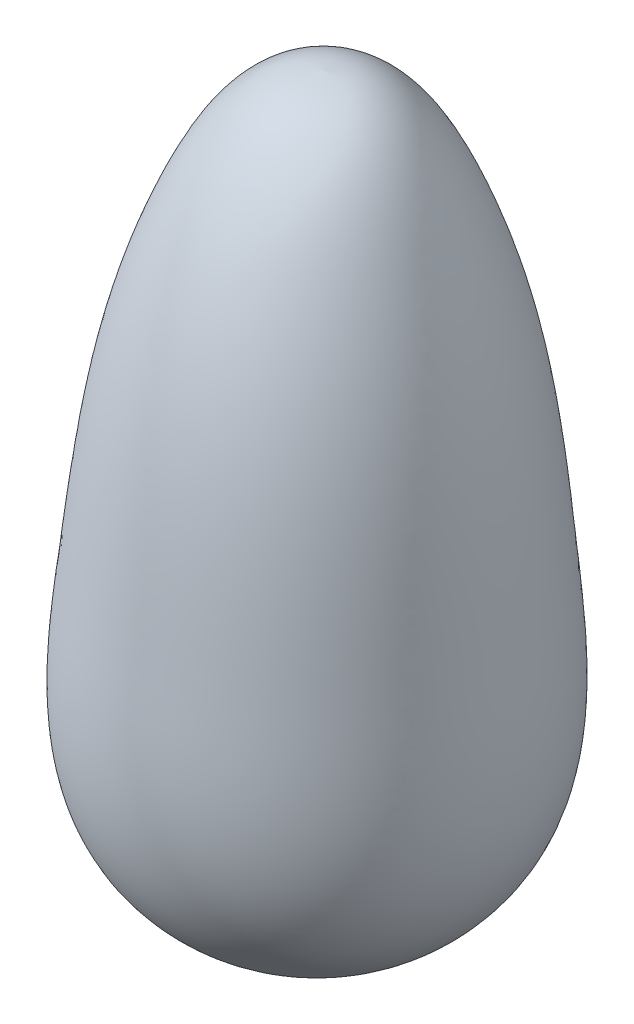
SolidWorks part; units mm, degrees
ref_plane "Ebene vorne" through (0, 0, 0) normal (0, 0, 1) x (1, 0, 0)
ref_plane "Ebene oben" through (0, 0, 0) normal (0, 1, 0) x (1, 0, 0)
ref_plane "Ebene rechts" through (0, 0, 0) normal (1, 0, 0) x (0, 0, -1)
sketch "Skizze1" plane through (0, 0, 0) normal (0, 0, 1) x (1, 0, 0)
  line L0 (0, 46.6651) -> (-1.3053, -42.9123) construction
  line L1 (0, 46.6651) -> (-1.3053, -44.3772)
  spline S0 degree 3 poles (0, 46.6651) (-1.0329, 46.5893) (-8.1078, 46.0698) (-19.8319, 25.0658) (-22.6855, -0.7432) (-26.3875, -30.9207) (-12.0374, -43.5546) (-4.3222, -44.1459) (-1.3053, -44.3772) knots 0 0 0 0 0.027386 0.187588 0.539338 0.794529 0.919655 1 1 1 1
revolve "Rotation1" add sketch "Skizze1" angle 360 about L1
